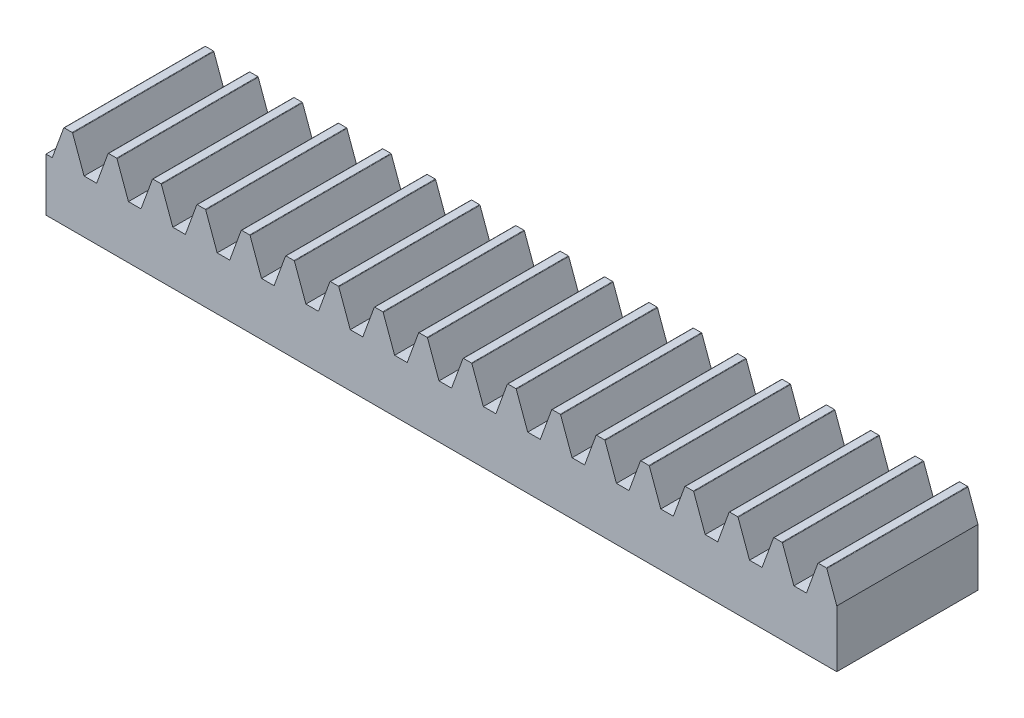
SolidWorks part; units mm, degrees
extrude "Blank" add sketch "BlankSke" against normal blind 10
sketch "BlankSke" plane through (0, 0, 0) normal (0, 0, 1) x (1, 0, 0)
  line L1 (0, 0) -> (56, 0)
  line L2 (0, 0) -> (0, 6)
  line L3 (0, 6) -> (56, 6)
  line L4 (56, 0) -> (56, 6)
ref_plane "Plane1" through (0, 0, 0) normal (0, 0, 1) x (1, 0, 0)
ref_plane "Plane2" through (0, 0, 0) normal (0, 1, 0) x (1, 0, 0)
ref_plane "Plane3" through (0, 0, 0) normal (1, 0, 0) x (0, 0, -1)
other "Configuration Table"
sketch "HoldingSke" plane through (0, 0, 0) normal (0, 1, 0) x (1, 0, 0)
  line L0 (0, 0) -> (0.1392, 0.9903)
  line L1 (-15, 0) -> (100, 0) construction
  line L2 (0, 0) -> (-2.1039, 2.3779)
  line L3 (0, 0) -> (-11.863, 4.5341)
  line L4 (0, 0) -> (7.8894, 3.5126)
  line L5 (0, 0) -> (-23.7986, -8.8762)
  line L6 (0, 0) -> (-10.5278, -7.1032)
  line L9 (-71.009, 38.7566) -> (-3.3511, 63.3821)
  line L10 (-76.2, 3.3779) -> (-71.2, 3.3779)
  line L11 (0, 0) -> (-10, 0)
  line L12 (-76.2, 101.6) -> (-76.162, 101.6)
  line L13 (24.9733, 27.94) -> (52.9518, 28.4284)
  line L14 (24.9733, 27.94) -> (24.9743, 27.94)
  line L15 (24.9733, 27.94) -> (100.4006, 29.5858)
  circle A0 centre (0, 0) radius 19.05
  circle A1 centre (0, 0) radius 2.5
  circle A2 centre (0, 0) radius 12.7
sketch "TooCutSkeIll" plane through (0, 0, 0) normal (0, 0, 1) x (1, 0, 0)
  line L0 (-1.2538, 5.9737) -> (-0.5045, 3.9152)
  line L1 (-0.2687, 3.75) -> (0.2687, 3.75)
  line L2 (0.5045, 3.9152) -> (1.2538, 5.9737)
  line L3 (56, 6) -> (0, 6) construction
  line L4 (0, 0) -> (0, 64.897) construction
  line L5 (-13.208, 5) -> (12.954, 5) construction
  line L6 (0, 0) -> (56, 0) construction
  line L7 (0.8994, 5) -> (0.8994, 48.7463) construction
  line L8 (-0.8994, 5) -> (-0.8994, 48.7463) construction
  line L9 (1.2914, 6) -> (1.2914, 6.0254)
  line L10 (-1.2914, 6) -> (-1.2914, 6.0254)
  line L11 (-1.2914, 6.0254) -> (1.2914, 6.0254)
  arc A0 (0.2687, 3.75) -> (0.5045, 3.9152) centre (0.2687, 4.001) ccw
  arc A1 (-0.5045, 3.9152) -> (-0.2687, 3.75) centre (-0.2687, 4.001) ccw
  arc A2 (1.2914, 6) -> (1.2538, 5.9737) centre (1.2914, 5.96) ccw
  arc A3 (-1.2538, 5.9737) -> (-1.2914, 6) centre (-1.2914, 5.96) ccw
extrude "ToothCutIll" cut sketch "TooCutSkeIll" against normal through all
sketch "TooCutSkeSim" plane through (0, 0, 0) normal (0, 0, 1) x (1, 0, 0)
  line L0 (0.4444, 3.75) -> (-0.4444, 3.75)
  line L1 (1.2726, 6.0254) -> (0.4444, 3.75)
  line L2 (0, 17.4625) -> (0, 53.467) construction
  line L3 (1.2726, 6.0254) -> (-1.2726, 6.0254)
  line L6 (-1.2726, 6.0254) -> (-0.4444, 3.75)
  line L9 (-0.8994, 5) -> (0.8994, 5) construction
  line L10 (0, 0) -> (56, 0) construction
  line L11 (0.8994, 5) -> (0.8994, 53.467) construction
  line L12 (-0.8994, 5) -> (-0.8994, 53.467) construction
extrude "ToothCutSim" cut sketch "TooCutSkeSim" against normal through all
pattern_linear "TeethCuts" count 18 spacing 3.1416 along (1, 0, 0) of "ToothCutIll", "ToothCutSim"
equation "' \"Module@HoldingSke\" = 6.35"
equation "' \"Num_teeth@HoldingSke\" = 12"
equation "' \"Ap@HoldingSke\" =  20"
equation "' \"Ap@HoldingSke\" = 20"
equation "' \"Width@HoldingSke\" = 0.25 * 25.4"
equation "' \"Show_teeth@HoldingSke\" = 500"
equation "' \"Backlash@HoldingSke\" = 0.009 * 25.4"
equation "' \"Addendum_fac@HoldingSke\" = 1.0"
equation "' \"Dedendum_fac@HoldingSke\" = 1.25"
equation "' \"Dedendum_add@HoldingSke\" = 0.00005 * 25.4"
equation "' \"Clearance_fac@HoldingSke\" = 0.25"
equation "' \"Pitch_height@HoldingSke\" = 1 * 25.4"
equation "' \"Length@HoldingSke\" = 4.71 * 25.4"
equation "\"Pitch@HoldingSke\" = 1 / \"Module@HoldingSke\""
equation "\"MPH@HoldingSke\" = \"Dedendum_fac@HoldingSke\" / \"Pitch@HoldingSke\" + 2 * \"Dedendum_add@HoldingSke\" + 0.002 * 25.4"
equation "\"MPH@HoldingSke\" = ((sgn( \"MPH@HoldingSke\" - \"Pitch_height@HoldingSke\")+1)*( \"MPH@HoldingSke\" - \"Pitch_height@HoldingSke\"))/2 + \"Pitch_height@HoldingSke\""
equation "\"Blank_height@BlankSke\" = \"Pitch_height@HoldingSke\" + \"Addendum_fac@HoldingSke\"  / \"Pitch@HoldingSke\" "
equation "\"Face_width@Blank\" = \"Width@HoldingSke\""
equation "\"Pressure_angle@TooCutSkeIll\" = \"Ap@HoldingSke\""
equation "\"Addendum_plus@TooCutSkeIll\" =  \"Addendum_fac@HoldingSke\"  / \"Pitch@HoldingSke\" + 0.001 *25.4"
equation "\"Dedendum@TooCutSkeIll\" = \"Dedendum_fac@HoldingSke\"  / \"Pitch@HoldingSke\""
equation "\"Pitch_height@TooCutSkeIll\" =  \"MPH@HoldingSke\""
equation "\"Gap_width@TooCutSkeIll\" = 3.14159265 / 2 / \"Pitch@HoldingSke\" + 6 * \"Backlash@HoldingSke\""
equation "\"Pressure_angle@TooCutSkeSim\" = \"Ap@HoldingSke\""
equation "\"Addendum_plus@TooCutSkeSim\" =  \"Addendum_fac@HoldingSke\"  / \"Pitch@HoldingSke\" + 0.001 * 25.4"
equation "\"Dedendum@TooCutSkeSim\" = \"Dedendum_fac@HoldingSke\"  / \"Pitch@HoldingSke\""
equation "\"Pitch_height@TooCutSkeSim\" =  \"MPH@HoldingSke\""
equation "\"Gap_width@TooCutSkeSim\" = 3.14159265 / 2 / \"Pitch@HoldingSke\" + 6 * \"Backlash@HoldingSke\""
equation "\"Root_fillet@TooCutSkeIll\" = \"Clearance_fac@HoldingSke\" / \"Pitch@HoldingSke\" + \"Dedendum_add@HoldingSke\""
equation "\"Break_rad@TooCutSkeIll\" = 0.02 / \"Pitch@HoldingSke\" * 2"
equation "\"Linear_pitch@TeethCuts\" = 3.14159265 / \"Pitch@HoldingSke\""
equation "\"Num_teeth@HoldingSke\" = int( ( \"Length@HoldingSke\" + 0 ) / (3.14159265 / \"Pitch@HoldingSke\")) + 0.9999  + 1"
equation " \"Num_teeth@TeethCuts\" = int( \"Show_teeth@HoldingSke\" ) + 1"
equation " \"Num_teeth@TeethCuts\" = ((sgn( \"Num_teeth@TeethCuts\" - \"Num_teeth@HoldingSke\" )-1)*( \"Num_teeth@TeethCuts\" - \"Num_teeth@HoldingSke\" ))/-2+ \"Num_teeth@HoldingSke\""
equation " \"Num_teeth@TeethCuts\" = ((sgn( \"Num_teeth@TeethCuts\" - 2.0)+1)*( \"Num_teeth@TeethCuts\" - 2.0))/2 +2.0"
